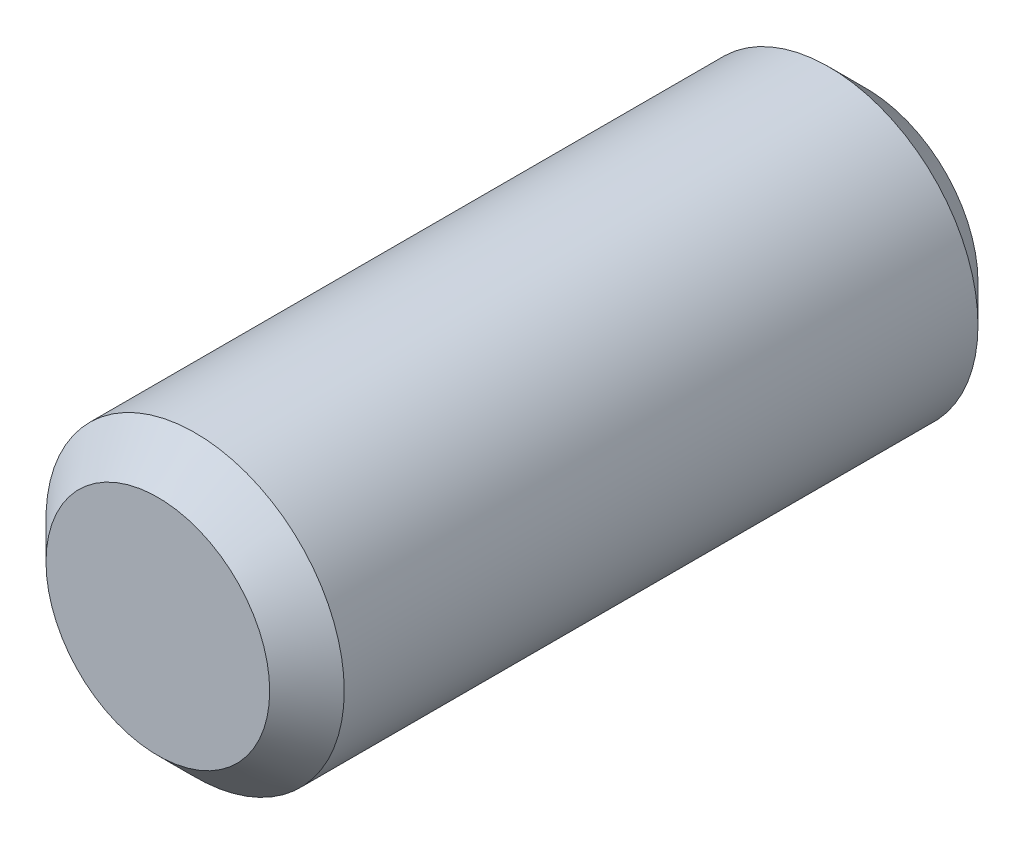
SolidWorks part; units mm, degrees
ref_plane "Plan1" through (0, 0, 0) normal (0, 0, 1) x (1, 0, 0)
ref_plane "Plan2" through (0, 0, 0) normal (0, 1, 0) x (1, 0, 0)
ref_plane "Plan3" through (0, 0, 0) normal (1, 0, 0) x (0, 0, -1)
sketch "Esquisse1" plane through (0, 0, 0) normal (0, 0, 1) x (1, 0, 0)
  circle A0 centre (0, 0) radius 2
  dimension "D1" = 4
extrude "BaseExtrusion" add sketch "Esquisse1" along normal blind 9.5
chamfer "Chanfrein1" distance 0.5 angle 45
